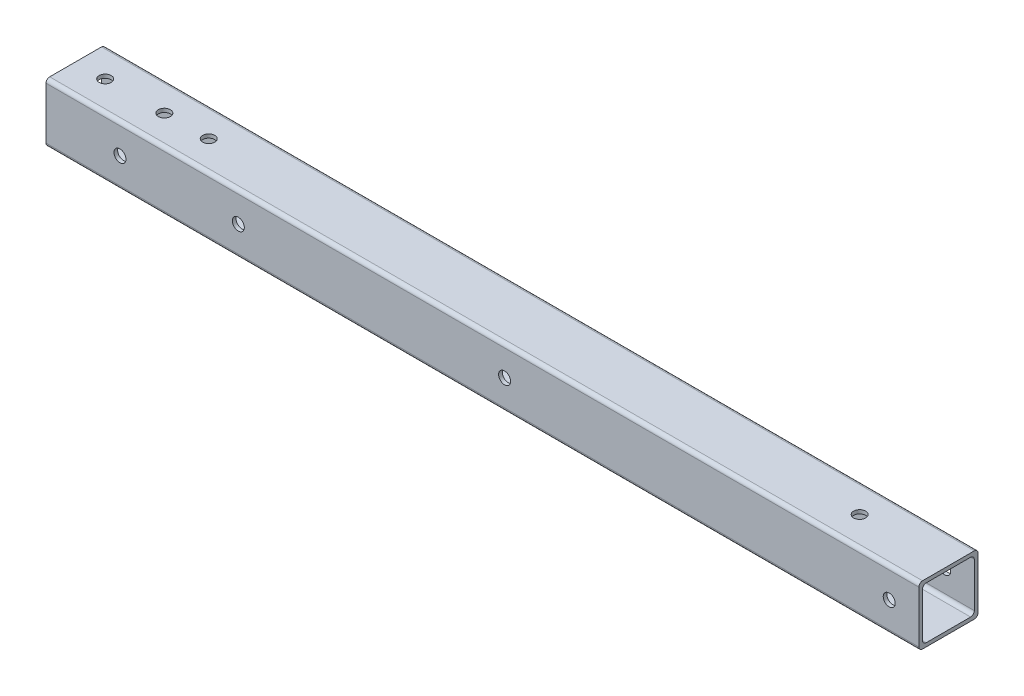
SolidWorks part; units mm, degrees
ref_plane "Front Plane" through (0, 0, 0) normal (0, 0, 1) x (1, 0, 0)
ref_plane "Top Plane" through (0, 0, 0) normal (0, 1, 0) x (1, 0, 0)
ref_plane "Right Plane" through (0, 0, 0) normal (1, 0, 0) x (0, 0, -1)
sketch "Sketch1" plane through (0, 0, 0) normal (0, 1, 0) x (1, 0, 0)
  line L1 (0, 0) -> (-1498.6, 0)
  line L2 (0, 0) -> (0, -101.6)
  line L3 (0, -101.6) -> (-1498.6, -101.6)
  line L4 (-1498.6, 0) -> (-1498.6, -101.6)
  dimension "D1" = 1498.6
  dimension "D2" = 101.6
extrude "Extrude1" add sketch "Sketch1" along normal blind 101.6
sketch "Sketch2" plane through (-1498.6, 0, 0) normal (-1, 0, 0) x (0, 0, 1)
  line L0 (0, 101.6) -> (101.6, 101.6) construction
  line L1 (6.35, 95.25) -> (95.25, 95.25)
  line L2 (6.35, 95.25) -> (6.35, 6.35)
  line L3 (6.35, 6.35) -> (95.25, 6.35)
  line L4 (95.25, 95.25) -> (95.25, 6.35)
  line L5 (0, 0) -> (101.6, 0) construction
  line L6 (101.6, 101.6) -> (101.6, 0) construction
  line L7 (0, 101.6) -> (0, 0) construction
  dimension "D1" = 6.35
  dimension "D2" = 6.35
  dimension "D3" = 6.35
  dimension "D4" = 6.35
extrude "Cut-Extrude1" cut sketch "Sketch2" against normal up to next
fillet "Fillet1" radius 6.35 8 edges at (-749.3, 6.35, 95.25) (-749.3, 0, 101.6) (-749.3, 101.6, 101.6) (-749.3, 95.25, 95.25) (-749.3, 95.25, 6.35) (-749.3, 101.6, 0) (-749.3, 6.35, 6.35) (-749.3, 0, 0)
sketch "Sketch3" plane through (0, 0, 0) normal (0, -1, 0) x (1, 0, 0)
  line L0 (0, 95.25) -> (0, 6.35) construction
  line L1 (-1498.6, 6.35) -> (0, 6.35) construction
  circle A0 centre (-1447.8, 50.8) radius 10.3188
  dimension "D1" = 20.6375
  dimension "D2" = 1447.8
  dimension "D3" = 44.45
extrude "Cut-Extrude2" cut sketch "Sketch3" against normal blind 101.6
sketch "Sketch4" plane through (0, 0, 0) normal (0, -1, 0) x (1, 0, 0)
  line L0 (0, 95.25) -> (0, 6.35) construction
  line L1 (-1498.6, 6.35) -> (0, 6.35) construction
  circle A0 centre (-1346.2, 50.8) radius 10.3188
  dimension "D1" = 20.6375
  dimension "D2" = 1346.2
  dimension "D3" = 44.45
extrude "Cut-Extrude3" cut sketch "Sketch4" against normal blind 101.6
sketch "Sketch5" plane through (0, 0, 0) normal (0, -1, 0) x (1, 0, 0)
  line L0 (0, 95.25) -> (0, 6.35) construction
  line L1 (-1498.6, 6.35) -> (0, 6.35) construction
  circle A0 centre (-1270, 50.8) radius 10.3188
  dimension "D1" = 20.6375
  dimension "D2" = 1270
  dimension "D3" = 44.45
extrude "Cut-Extrude4" cut sketch "Sketch5" against normal blind 101.6
sketch "Sketch6" plane through (0, 0, 0) normal (0, -1, 0) x (1, 0, 0)
  line L0 (0, 95.25) -> (0, 6.35) construction
  line L1 (-1498.6, 6.35) -> (0, 6.35) construction
  circle A0 centre (-152.4, 50.8) radius 10.3188
  dimension "D1" = 20.6375
  dimension "D2" = 152.4
  dimension "D3" = 44.45
extrude "Cut-Extrude5" cut sketch "Sketch6" against normal blind 101.6
sketch "Sketch7" plane through (0, 0, 101.6) normal (0, 0, 1) x (1, 0, 0)
  line L0 (0, 95.25) -> (0, 6.35) construction
  line L1 (-1498.6, 6.35) -> (0, 6.35) construction
  circle A0 centre (-1371.6, 50.8) radius 10.3188
  dimension "D1" = 20.6375
  dimension "D2" = 1371.6
  dimension "D3" = 44.45
extrude "Cut-Extrude6" cut sketch "Sketch7" against normal blind 101.6
sketch "Sketch8" plane through (0, 0, 101.6) normal (0, 0, 1) x (1, 0, 0)
  line L0 (0, 95.25) -> (0, 6.35) construction
  line L1 (-1498.6, 6.35) -> (0, 6.35) construction
  circle A0 centre (-50.8, 50.8) radius 10.3188
  dimension "D1" = 20.6375
  dimension "D2" = 50.8
  dimension "D3" = 44.45
extrude "Cut-Extrude7" cut sketch "Sketch8" against normal blind 101.6
sketch "Sketch9" plane through (0, 0, 101.6) normal (0, 0, 1) x (1, 0, 0)
  line L0 (0, 95.25) -> (0, 6.35) construction
  line L1 (0, 95.25) -> (-1498.6, 95.25) construction
  circle A0 centre (-711.2, 50.8) radius 10.3188
  dimension "D1" = 20.6375
  dimension "D2" = 711.2
  dimension "D3" = 44.45
extrude "Cut-Extrude8" cut sketch "Sketch9" against normal through all
sketch "Sketch10" plane through (0, 0, 101.6) normal (0, 0, 1) x (1, 0, 0)
  line L0 (0, 95.25) -> (0, 6.35) construction
  line L1 (0, 95.25) -> (-1498.6, 95.25) construction
  circle A0 centre (-1168.4, 50.8) radius 10.3188
  dimension "D1" = 20.6375
  dimension "D2" = 1168.4
  dimension "D3" = 44.45
extrude "Cut-Extrude9" cut sketch "Sketch10" against normal through all
